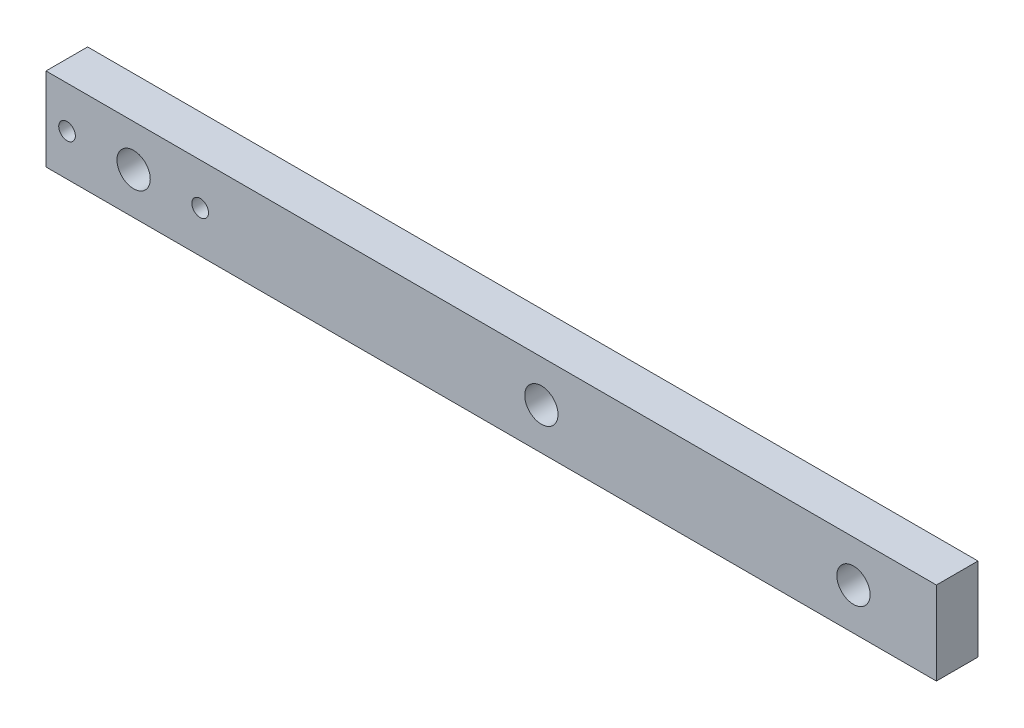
SolidWorks part; units mm, degrees
ref_plane "Front Plane" through (0, 0, 0) normal (0, 0, 1) x (1, 0, 0)
ref_plane "Top Plane" through (0, 0, 0) normal (0, 1, 0) x (1, 0, 0)
ref_plane "Right Plane" through (0, 0, 0) normal (1, 0, 0) x (0, 0, -1)
sketch "Sketch1" plane through (0, 0, 0) normal (0, 0, 1) x (1, 0, 0)
  line L1 (-55, 5) -> (52, 5)
  line L2 (-55, 5) -> (-55, -5)
  line L3 (-55, -5) -> (52, -5)
  line L4 (52, 5) -> (52, -5)
extrude "Boss-Extrude1" add sketch "Sketch1" along normal blind 5
sketch "Sketch2" plane through (0, 0, 5) normal (0, 0, 1) x (1, 0, 0)
  line L0 (-55, 5) -> (-55, -5) construction
  circle A0 centre (-44.4705, 0) radius 2
  circle A1 centre (-52.4705, 0) radius 1
  circle A2 centre (-36.4705, 0) radius 1
  circle A3 centre (42.0359, 0) radius 2
  circle A4 centre (4.5295, 0) radius 2
  dimension "D1" = 10.5295
  dimension "D2" = 8
  dimension "D3" = 8
  dimension "D5" = 49
  dimension "D6" = 37.5065
extrude "Cut-Extrude1" cut sketch "Sketch2" against normal blind 5
sketch "Sketch3" plane through (0, 0, 5) normal (0, 0, 1) x (1, 0, 0)
  line L0 (-55, 0) -> (52, 0)
  line L1 (-55, 5) -> (-55, -5) construction
  line L2 (52, -5) -> (52, 5) construction
